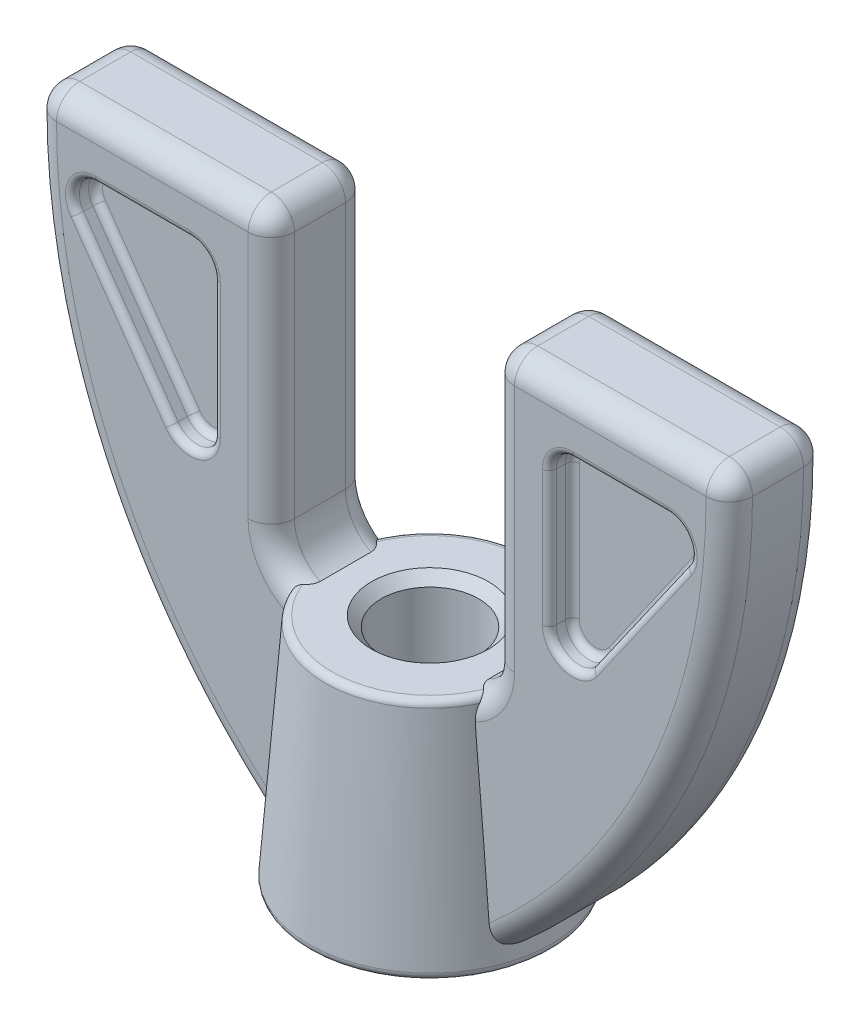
SolidWorks part; units mm, degrees
ref_plane "前视基准面" through (0, 0, 0) normal (0, 0, 1) x (1, 0, 0)
ref_plane "上视基准面" through (0, 0, 0) normal (0, 1, 0) x (1, 0, 0)
ref_plane "右视基准面" through (0, 0, 0) normal (1, 0, 0) x (0, 0, -1)
sketch "草图1" plane through (0, 0, 0) normal (0, 0, 1) x (1, 0, 0)
  line L0 (0, 18.8532) -> (0, -16.2844) construction
  line L1 (0, 10) -> (4.5, 10)
  line L2 (4.5, 10) -> (5.25, 0)
  line L3 (5.25, 0) -> (0, 0)
  line L4 (0, 10) -> (0, 0)
  dimension "D1" = 10.5
  dimension "D2" = 9
  dimension "D3" = 10
revolve "旋转1" add sketch "草图1" angle 360 about L0
hole_wizard "M5 螺纹孔1" positions "草图2" profile "草图3" tap size "M5" standard "GB"
sketch "草图2" plane through (0, 10, 0) normal (0, 1, 0) x (1, 0, 0)
  point P0 (0, 0)
sketch "草图3" plane through (0, 10, 0) normal (1, 0, 0) x (0, 0, 1)
  line L0 (0, 0) -> (0, 13.6618)
  line L1 (0, 13.6618) -> (2.1, 12.4)
  line L2 (2.1, 12.4) -> (2.1, 0.425)
  line L3 (2.1, 0.425) -> (2.525, 0)
  line L5 (2.525, 0) -> (0, 0)
  line L6 (-2.1, 0.425) -> (-2.525, 0) construction
  line L10 (0, 13.6618) -> (-2.1, 12.4) construction
  line L11 (0, -6.35) -> (0, 107.95) construction
  dimension "螺纹孔钻头直径" = 4.2
  dimension "螺纹孔钻头深度" = 12.4
  dimension "近端锥形沉头孔直径" = 5.05
  dimension "近端锥形沉头孔角度" = 90
  dimension "导头角度" = 118
sketch "草图4" plane through (0, 0, 0) normal (0, 0, 1) x (1, 0, 0)
  line L0 (-15, 23.5) -> (-4.75, 23.5)
  line L1 (0, 0) -> (0, 27.7651) construction
  line L2 (-5.25, 0) -> (5.25, 0) construction
  line L3 (-4.75, 23.5) -> (-4.75, 9.8)
  line L4 (4.75, 23.5) -> (4.75, 9.8)
  line L5 (2.9454, 9.8) -> (4.75, 9.8)
  line L6 (-2.9459, 9.8) -> (-4.75, 9.8)
  line L7 (4.5, 10) -> (-4.5, 10) construction
  line L8 (5.25, 0) -> (4.5, 10) construction
  line L10 (-4.5, 10) -> (-5.25, 0) construction
  line L11 (-14, 15) -> (14, 15) construction
  line L12 (4.75, 23.5) -> (15, 23.5)
  line L13 (-2.9459, 9.8) -> (-3.7185, 1)
  line L14 (-3.7185, 1) -> (-5.175, 1)
  line L16 (2.9454, 9.8) -> (3.673, 1)
  line L17 (3.673, 1) -> (5.175, 1)
  arc A0 (-15, 23.5) -> (-5.175, 1) centre (13.482, 22.542) ccw
  arc A1 (5.175, 1) -> (15, 23.5) centre (-13.482, 22.542) ccw
  point P5 (-4.75, 23.5)
  point P6 (4.75, 23.5)
  dimension "D1" = 30
  dimension "D2" = 23.5
  dimension "D3" = 9.5
  dimension "D4" = 1
  dimension "D5" = 1
  dimension "D6" = 15
  dimension "D7" = 28
  dimension "D8" = 0.2
  dimension "D9" = 0.2
extrude "凸台-拉伸1" add sketch "草图4" along normal mid plane 4.2 separate body
fillet "圆角1" radius 2 1 edges at (-4.75, 9.8, 0)
fillet "圆角2" radius 2 1 edges at (4.75, 9.8, 0)
fillet "圆角3" radius 1 2 edges at (-15, 23.5, 0) (-4.75, 23.5, 0)
fillet "圆角4" radius 1 2 edges at (15, 23.5, 0) (4.75, 23.5, 0)
fillet "圆角5" radius 1 12 edges at (-4.2319, 10.4472, -2.1) (-12.4303, 10.6805, -2.1) (-14.7237, 23.2066, -2.1) (-9.883, 23.5, -2.1) (-5.0429, 23.2071, -2.1) (-4.2319, 10.4472, 2.1) (-4.75, 17.1452, 2.1) (-5.0429, 23.2071, 2.1) (-12.4303, 10.6805, 2.1) (-14.7237, 23.2066, 2.1) (-4.75, 17.1452, -2.1) (-9.883, 23.5, 2.1)
fillet "圆角6" radius 1 14 edges at (4.424, 1, 2.1) (4.2317, 10.4471, -2.1) (4.2317, 10.4471, 2.1) (9.883, 23.5, -2.1) (9.883, 23.5, 2.1) (4.75, 17.1452, -2.1) (5.0429, 23.2071, -2.1) (14.7237, 23.2066, -2.1) (4.75, 17.1452, 2.1) (5.0429, 23.2071, 2.1) (14.7237, 23.2066, 2.1) (12.4303, 10.6805, 2.1) (4.424, 1, -2.1) (12.4303, 10.6805, -2.1)
sketch "草图5" plane through (0, 0, 2.1) normal (0, 0, 1) x (1, 0, 0)
  line L0 (-12.3293, 21) -> (-8.25, 21)
  line L1 (-7.25, 20) -> (-7.25, 14.1724)
  line L2 (-9.0692, 13.5989) -> (-13.1486, 19.4265)
  line L3 (-14.0161, 23.5) -> (-5.75, 23.5) construction
  line L4 (-4.75, 22.5) -> (-4.75, 11.7904) construction
  arc A0 (-9.0692, 13.5989) -> (-7.25, 14.1724) centre (-8.25, 14.1724) ccw
  arc A1 (-7.25, 20) -> (-8.25, 21) centre (-8.25, 20) ccw
  arc A2 (-13.1486, 19.4265) -> (-12.3293, 21) centre (-12.3293, 20) cw
  point P9 (-7.25, 11)
  point P12 (-7.25, 21)
  point P15 (-14.25, 21)
  point P21 (7.25, 11)
  dimension "D5" = 1
  dimension "D1" = 7
  dimension "D2" = 10
  dimension "D3" = 2.5
  dimension "D4" = 2.5
extrude "切除-拉伸1" cut sketch "草图5" against normal blind 1
sketch "草图6" plane through (0, 0, 2.1) normal (0, 0, 1) x (1, 0, 0)
  line L0 (8.25, 21) -> (12.3293, 21)
  line L1 (13.1486, 19.4265) -> (9.0692, 13.5989)
  line L2 (7.25, 14.1724) -> (7.25, 20)
  line L3 (4.75, 11.7904) -> (4.75, 22.5) construction
  line L4 (5.75, 23.5) -> (14.0161, 23.5) construction
  arc A0 (9.0692, 13.5989) -> (7.25, 14.1724) centre (8.25, 14.1724) cw
  arc A1 (12.3293, 21) -> (13.1486, 19.4265) centre (12.3293, 20) cw
  arc A2 (7.25, 20) -> (8.25, 21) centre (8.25, 20) cw
  point P9 (7.25, 11)
  point P12 (14.25, 21)
  point P15 (7.25, 21)
  dimension "D5" = 1
  dimension "D1" = 7
  dimension "D2" = 10
  dimension "D3" = 2.5
  dimension "D4" = 2.5
extrude "切除-拉伸2" cut sketch "草图6" against normal blind 1
mirror "镜向8" about plane through (0, 0, 0) normal (0, 0, 1) of "切除-拉伸2"
mirror "镜向9" about plane through (0, 0, 0) normal (0, 0, 1) of "切除-拉伸1"
fillet "圆角8" radius 0.3 24 edges at (-13.2163, 20.4618, -1.1) (-10.2897, 21, -1.1) (-7.5429, 20.7071, -1.1) (-7.25, 17.0862, -1.1) (-7.9494, 13.2186, -1.1) (-11.1089, 16.5127, -2.1) (-13.2163, 20.4618, -2.1) (-10.2897, 21, -2.1) (-7.5429, 20.7071, -2.1) (-7.25, 17.0862, -2.1) (-11.1089, 16.5127, 1.1) (-13.2163, 20.4618, 1.1) (-10.2897, 21, 1.1) (-7.5429, 20.7071, 1.1) (-7.25, 17.0862, 1.1) (-11.1089, 16.5127, 2.1) (-13.2163, 20.4618, 2.1) (-10.2897, 21, 2.1) (-7.5429, 20.7071, 2.1) (-7.25, 17.0862, 2.1) (-11.1089, 16.5127, -1.1) (-7.9494, 13.2186, -2.1) (-7.9494, 13.2186, 1.1) (-7.9494, 13.2186, 2.1)
fillet "圆角9" radius 0.3 24 edges at (7.9494, 13.2186, -2.1) (11.1089, 16.5127, -2.1) (13.2163, 20.4618, -2.1) (10.2897, 21, -2.1) (7.5429, 20.7071, -2.1) (7.25, 17.0862, -2.1) (7.9494, 13.2186, -1.1) (11.1089, 16.5127, -1.1) (13.2163, 20.4618, -1.1) (10.2897, 21, -1.1) (7.5429, 20.7071, -1.1) (7.25, 17.0862, -1.1) (7.9494, 13.2186, 1.1) (7.25, 17.0862, 1.1) (7.5429, 20.7071, 1.1) (10.2897, 21, 1.1) (13.2163, 20.4618, 1.1) (11.1089, 16.5127, 1.1) (7.9494, 13.2186, 2.1) (11.1089, 16.5127, 2.1) (13.2163, 20.4618, 2.1) (10.2897, 21, 2.1) (7.5429, 20.7071, 2.1) (7.25, 17.0862, 2.1)
fillet "圆角10" radius 0.3 2 edges at (0, 0, 5.25) (0, 10, 4.5)
equation "\"Dummy1\"= \"图号代码\""
equation "\"Dummy2\"= \"名称代码\""
